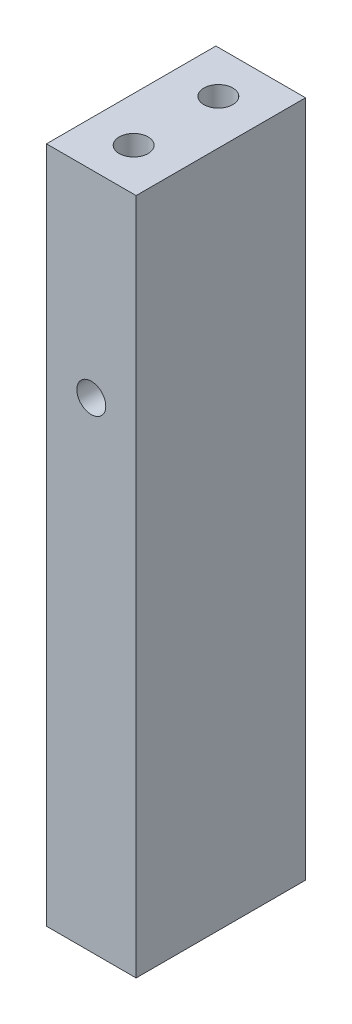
SolidWorks part; units mm, degrees
ref_plane "Plano frontal" through (0, 0, 0) normal (0, 0, 1) x (1, 0, 0)
ref_plane "Plano superior" through (0, 0, 0) normal (0, 1, 0) x (1, 0, 0)
ref_plane "Plano direito" through (0, 0, 0) normal (1, 0, 0) x (0, 0, -1)
sketch "Esboço1" plane through (0, 0, 0) normal (0, 0, 1) x (1, 0, 0)
  line L1 (0, 0) -> (6.35, 0)
  line L2 (0, 0) -> (0, 48)
  line L3 (0, 48) -> (6.35, 48)
  line L4 (6.35, 0) -> (6.35, 48)
  dimension "D1" = 48
  dimension "D2" = 6.35
extrude "Ressalto-extrusão1" add sketch "Esboço1" along normal blind 12
sketch "Esboço2" plane through (0, 0, 0) normal (0, -1, 0) x (-1, 0, 0)
  line L0 (-3.175, -12) -> (-3.175, 0) construction
  line L1 (0, 0) -> (-6.35, 0) construction
  line L2 (0, 0) -> (0, -12) construction
  line L3 (0, -12) -> (-6.35, -12) construction
  line L4 (-6.35, 0) -> (-6.35, -12) construction
  point P8 (-3.175, -9)
  point P9 (-3.175, -3)
  dimension "D1" = 9
  dimension "D2" = 6
hole_wizard "Furo roscado de M2.51" positions "3DSketch1" profile "Esboço3" tap size "M2.5" standard "ISO"
sketch3d "3DSketch1"
  point P0 (3.175, 0, 9)
  point P3 (3.175, 0, 3)
sketch "Esboço3" plane through (3.175, 0, 9) normal (1, 0, 0) x (0, 0, -1)
  line L0 (0, 0) -> (0, 10.6159)
  line L1 (0, 10.6159) -> (1.025, 10)
  line L2 (1.025, 10) -> (1.025, 0)
  line L5 (1.025, 0) -> (0, 0)
  line L10 (0, 10.6159) -> (-1.025, 10) construction
  line L11 (0, -6.35) -> (0, 107.95) construction
  dimension "Tap Drill Dia." = 2.05
  dimension "Tap Drill Depth" = 10
  dimension "Drill Angle" = 118
sketch "Esboço4" plane through (0, 0, 12) normal (0, 0, 1) x (1, 0, 0)
  line L0 (3.175, 48) -> (3.175, 0) construction
  line L1 (6.35, 48) -> (0, 48) construction
  point P5 (3.175, 34)
  point P6 (3.175, 28)
  dimension "D1" = 14
  dimension "D2" = 6
sketch "Esboço5" plane through (0, 48, 0) normal (0, 1, 0) x (1, 0, 0)
  line L0 (3.175, 0) -> (3.175, -12) construction
  point P4 (3.175, -3)
  point P5 (3.175, -9)
hole_wizard "Furo roscado de M2.53" positions "3DSketch3" profile "Esboço7" tap size "M2.5" standard "ISO"
sketch3d "3DSketch3"
  point P0 (3.175, 48, 3)
  point P3 (3.175, 48, 9)
sketch "Esboço7" plane through (3.175, 48, 3) normal (1, 0, 0) x (0, 0, 1)
  line L0 (0, 0) -> (0, 10)
  line L1 (0, 10) -> (1.025, 9.3841)
  line L2 (1.025, 9.3841) -> (1.025, 0)
  line L5 (1.025, 0) -> (0, 0)
  line L10 (0, 10) -> (-1.025, 9.3841) construction
  line L11 (0, -6.35) -> (0, 107.95) construction
  dimension "Tap Drill Dia." = 2.05
  dimension "Tap Drill Depth" = 10
  dimension "Drill Angle" = 118
hole_wizard "Furo roscado de M2.54" positions "3DSketch4" profile "Esboço8" tap size "M2.5" standard "ISO"
sketch3d "3DSketch4"
  point P0 (3.175, 34, 12)
sketch "Esboço8" plane through (3.175, 34, 12) normal (1, 0, 0) x (0, -1, 0)
  line L0 (0, 0) -> (0, 10)
  line L1 (0, 10) -> (1.025, 9.3841)
  line L2 (1.025, 9.3841) -> (1.025, 0)
  line L5 (1.025, 0) -> (0, 0)
  line L10 (0, 10) -> (-1.025, 9.3841) construction
  line L11 (0, -6.35) -> (0, 107.95) construction
  dimension "Tap Drill Dia." = 2.05
  dimension "Tap Drill Depth" = 10
  dimension "Drill Angle" = 118
